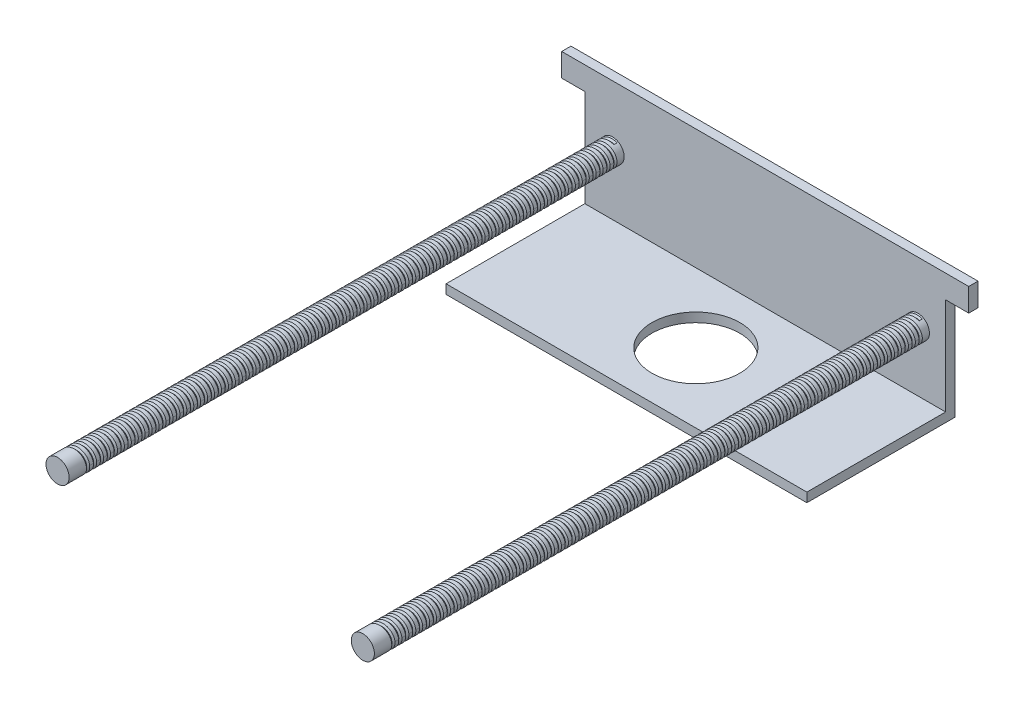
SolidWorks part; units mm, degrees
ref_plane "Piano frontale" through (0, 0, 0) normal (0, 0, 1) x (1, 0, 0)
ref_plane "Piano superiore" through (0, 0, 0) normal (0, 1, 0) x (1, 0, 0)
ref_plane "Piano destro" through (0, 0, 0) normal (1, 0, 0) x (0, 0, -1)
sketch "Schizzo1" plane through (0, 0, 0) normal (0, 0, 1) x (1, 0, 0)
  line L0 (-39, 14) -> (-44, 14)
  line L1 (-39, -14) -> (39, -14)
  line L2 (-39, -14) -> (-39, 9)
  line L3 (-39, 14) -> (39, 14)
  line L4 (39, -14) -> (39, 9)
  line L5 (-39, -14) -> (39, 14) construction
  line L6 (-39, 14) -> (39, -14) construction
  line L7 (-44, 14) -> (-44, 9)
  line L8 (-44, 9) -> (-39, 9)
  line L9 (0, 0) -> (0, 39.5987) construction
  line L10 (44, 9) -> (39, 9)
  line L11 (44, 14) -> (44, 9)
  line L12 (39, 14) -> (44, 14)
  point P0 (0, 0)
  dimension "D1" = 78
  dimension "D2" = 23
  dimension "D3" = 5
  dimension "D4" = 5
extrude "Estrusione-Estrusione1" add sketch "Schizzo1" along normal blind 2 contours L2 L8 L7 L0 L3 L12 L11 L10 L4 L1
sketch "Schizzo2" plane through (0, 0, 2) normal (0, 0, 1) x (1, 0, 0)
  line L0 (-39, -14) -> (39, -14) construction
  line L1 (-39, -14) -> (-39, 9) construction
  line L2 (39, -14) -> (39, 9) construction
  circle A0 centre (-33, 1) radius 2.5
  circle A1 centre (33, 1) radius 2.5
  dimension "D1" = 5
  dimension "D2" = 5
  dimension "D3" = 15
  dimension "D4" = 6
  dimension "D5" = 6
extrude "Estrusione-Estrusione2" add sketch "Schizzo2" along normal blind 120 contours A0 | A1
thread "Filettatura2" pitch 0.8 start angle 0, offset 3, length 0, pitch 1.5, diameter 5
ref_plane "Piano2" through (-35.5, 1, 119) normal (0, -1, 0) x (-1, 0, 0)
sketch "Profilo filettatura2" plane through (-35.5, 1, 119) normal (0, -1, 0) x (-1, 0, 0)
  line L0 (0, 0) -> (0, 0.8) construction
  line L11 (0, 0) -> (0, 0.7)
  line L12 (0, 0.7) -> (-0.433, 0.45)
  line L13 (-0.433, 0.45) -> (-0.433, 0.25)
  line L15 (-0.433, 0.25) -> (0, 0)
  line L17 (-0.433, 0.35) -> (0, 0.35) construction
  point P2 (0, 0)
  dimension "Pitch" = 0.8
  dimension "Profile_Angle" = 60
  dimension "Profile_Land" = 0.2
  dimension "Profile_Height" = 0.433
thread "Filettatura3" pitch 0.8 start angle 0, offset 3, length 0, pitch 1.5, diameter 5
ref_plane "Piano3" through (30.5, 1, 119) normal (0, -1, 0) x (-1, 0, 0)
sketch "Profilo filettatura3" plane through (30.5, 1, 119) normal (0, -1, 0) x (-1, 0, 0)
  line L0 (0, 0) -> (0, 0.8) construction
  line L11 (0, 0) -> (0, 0.7)
  line L12 (0, 0.7) -> (-0.433, 0.45)
  line L13 (-0.433, 0.45) -> (-0.433, 0.25)
  line L15 (-0.433, 0.25) -> (0, 0)
  line L17 (-0.433, 0.35) -> (0, 0.35) construction
  point P2 (0, 0)
  dimension "Pitch" = 0.8
  dimension "Profile_Angle" = 60
  dimension "Profile_Land" = 0.2
  dimension "Profile_Height" = 0.433
sketch "Schizzo3" plane through (0, 0, 2) normal (0, 0, 1) x (1, 0, 0)
  line L0 (39, -14) -> (39, 9) construction
  line L1 (-39, -14) -> (39, -14)
  line L2 (-39, -14) -> (-39, -12)
  line L3 (-39, -12) -> (39, -12)
  line L4 (39, -14) -> (39, -12)
  dimension "D1" = 2
extrude "Estrusione-Estrusione3" add sketch "Schizzo3" along normal blind 30 contours L3 L4 L1 L2
sketch "Schizzo5" plane through (0, -12, 0) normal (0, 1, 0) x (1, 0, 0)
  line L0 (-44, -2) -> (44, -2) construction
  circle A0 centre (0, -17) radius 9.5
  dimension "D1" = 19
  dimension "D2" = 15
extrude "Taglio-Estrusione1" cut sketch "Schizzo5" against normal up to next contours A0
